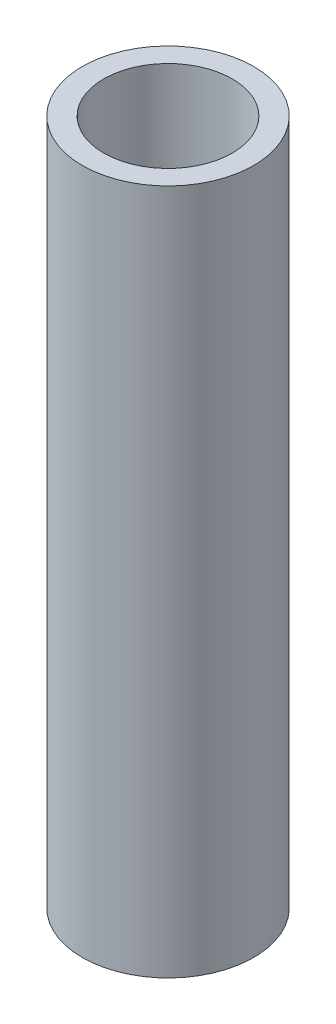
SolidWorks part; units mm, degrees
ref_plane "Front Plane" through (0, 0, 0) normal (0, 0, 1) x (1, 0, 0)
ref_plane "Top Plane" through (0, 0, 0) normal (0, 1, 0) x (1, 0, 0)
ref_plane "Right Plane" through (0, 0, 0) normal (1, 0, 0) x (0, 0, -1)
sketch "Sketch2" plane through (0, 0, 0) normal (0, 1, 0) x (1, 0, 0)
  circle A0 centre (0, 0) radius 25.4
  circle A1 centre (0, 0) radius 19.05
  dimension "D1" = 38.1
  dimension "D2" = 50.8
extrude "Boss-Extrude1" add sketch "Sketch2" along normal blind 203.2
